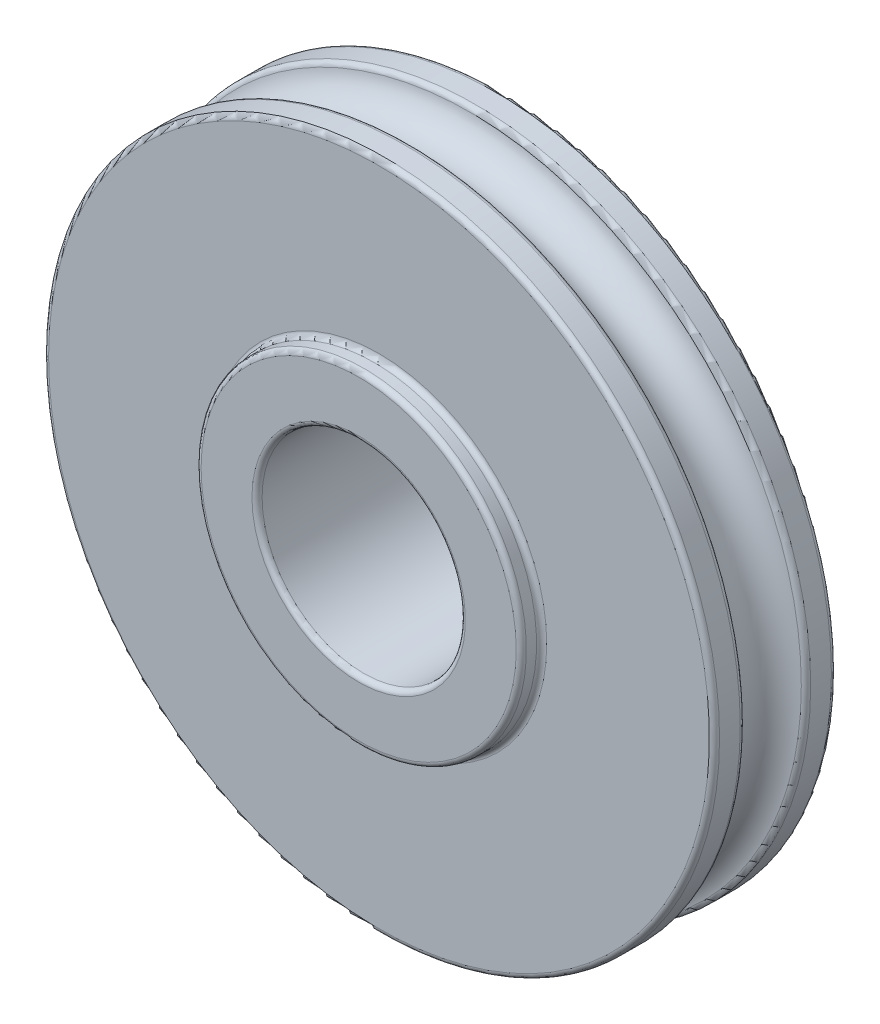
SolidWorks part; units mm, degrees
ref_plane "Спереди" through (0, 0, 0) normal (0, 0, 1) x (1, 0, 0)
ref_plane "Сверху" through (0, 0, 0) normal (0, 1, 0) x (1, 0, 0)
ref_plane "Справа" through (0, 0, 0) normal (1, 0, 0) x (0, 0, -1)
sketch "Эскиз1" plane through (0, 0, 0) normal (1, 0, 0) x (0, 0, -1)
  line L0 (-4, 0) -> (4, 0) construction
  line L1 (-1.5, 16.5) -> (-3, 16.5)
  line L2 (-3, 16.5) -> (-3, 8)
  line L3 (-3, 8) -> (-4, 8)
  line L4 (-4, 8) -> (-4, 5)
  line L5 (-4, 5) -> (4, 5)
  line L6 (4, 5) -> (4, 8)
  line L7 (4, 8) -> (3, 8)
  line L8 (3, 8) -> (3, 16.5)
  line L9 (3, 16.5) -> (1.5, 16.5)
  arc A0 (-1.5, 16.5) -> (1.5, 16.5) centre (0, 16.5) ccw
  dimension "D6" = 1.5
  dimension "D1" = 8
  dimension "D2" = 10
  dimension "D3" = 33
  dimension "D4" = 16
  dimension "D5" = 6
revolve "Повернуть1" add sketch "Эскиз1" angle 360 about L0
fillet "Скругление1" radius 0.25 10 edges at (8, 0, -4) (8, 0, -3) (16.5, 0, -3) (16.5, 0, -1.5) (16.5, 0, 1.5) (16.5, 0, 3) (8, 0, 3) (8, 0, 4) (5, 0, 4) (5, 0, -4)
